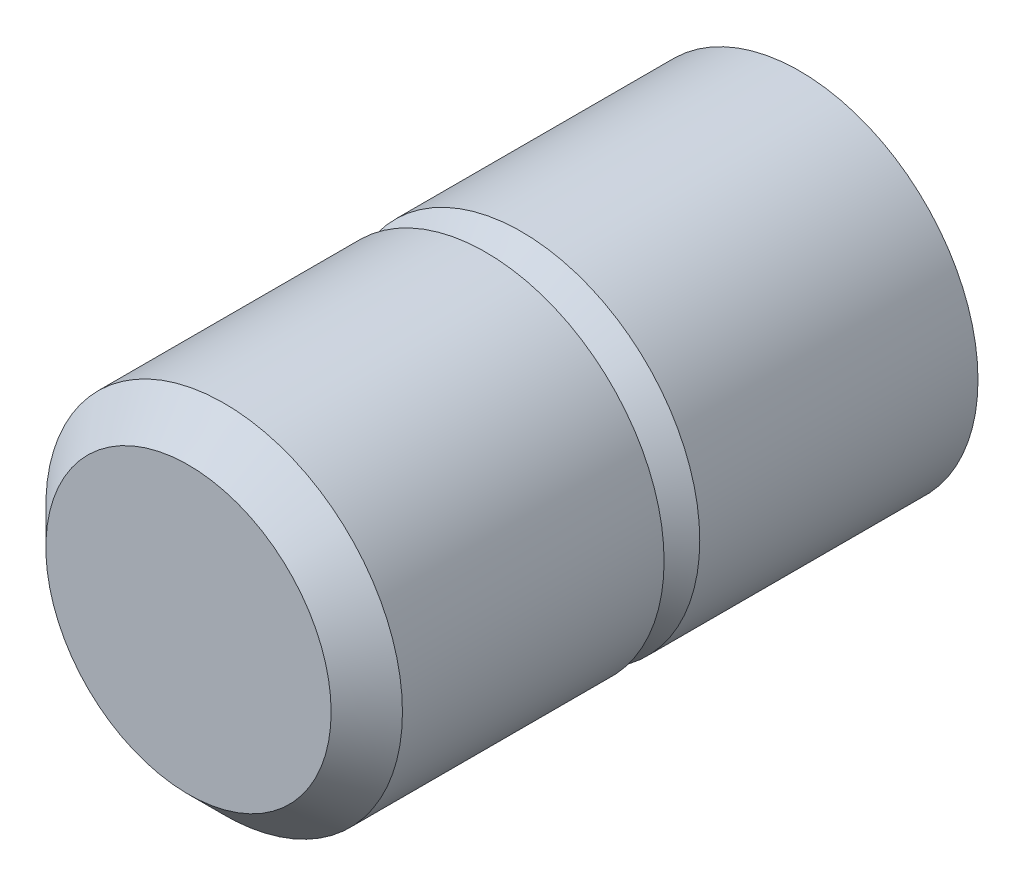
SolidWorks part; units mm, degrees
ref_plane "Front" through (0, 0, 0) normal (0, 0, 1) x (1, 0, 0)
ref_plane "Top" through (0, 0, 0) normal (0, 1, 0) x (1, 0, 0)
ref_plane "Right" through (0, 0, 0) normal (1, 0, 0) x (0, 0, -1)
sketch "Sketch1" plane through (0, 0, 0) normal (1, 0, 0) x (0, 0, -1)
  line L0 (0, 0) -> (65.3053, 0) construction
  line L1 (0, 0) -> (0, 4.8016)
  line L2 (0, 4.8016) -> (1.2004, 6.002)
  line L3 (1.2004, 6.002) -> (10.0076, 6.002)
  line L4 (10.0076, 6.002) -> (10.0076, 4.8016)
  line L5 (10.0076, 4.8016) -> (11.208, 6.002)
  line L6 (11.208, 6.002) -> (20.574, 6.002)
  line L7 (20.574, 6.002) -> (20.574, 4.6406)
  line L8 (20.574, 4.6406) -> (21.6052, 5.1562)
  line L9 (21.6052, 5.1562) -> (52.5628, 5.1562)
  line L10 (52.5628, 5.1562) -> (53.594, 4.125)
  line L11 (53.594, 4.125) -> (53.594, 0)
  line L12 (0, 0) -> (53.594, 0)
  dimension "D" = 12.004
  dimension "DChamp1" = 1.2004
  dimension "DChamp2" = 1.2004
  dimension "E" = 10.0076
  dimension "DChamp4" = 1.2004
  dimension "DChamp3" = 1.2004
  dimension "B" = 20.574
  dimension "CChamp1" = 1.0312
  dimension "A" = 53.594
  dimension "CChamp3" = 1.0312
  dimension "CChamp4" = 1.0312
  dimension "C" = 10.3124
  dimension "D2" = 12.004
  dimension "CChamp5" = 9.2812
revolve "Revolve1" add sketch "Sketch1" angle 360 about L0
sketch "Sketch2" plane through (0, 0, -20.574) normal (0, 0, -1) x (-1, 0, 0)
  circle A0 centre (0, 0) radius 53.975
  dimension "D1" = 107.95
extrude "Type123-N" cut sketch "Sketch2" along normal through all
sketch "123KeyDepth" [suppressed] plane through (0, 0, -28.448) normal (0, 0, -1) x (-1, 0, 0)
  line L0 (0, 0) -> (0, 1.5748) construction
  line L1 (-0.5766, 1.5748) -> (0.5714, 1.5748) construction
  dimension "KeyDepth" = 3.5687
ref_plane "123Plane" [suppressed] through (0, 1.5748, 0) normal (0, -1, 0) x (1, 0, 0)
sketch "Sketch4" [suppressed] plane through (0, 1.5748, 0) normal (0, -1, 0) x (1, 0, 0)
  line L0 (0.0026, -28.448) -> (0.0026, -38.0533) construction
  line L1 (0.5766, -28.448) -> (-0.5714, -28.448) construction
  line L2 (0.8027, -28.448) -> (0.8027, -19.812)
  line L3 (-0.7975, -19.812) -> (-0.7975, -28.448)
  line L5 (-3.9689, -19.812) -> (2.9563, -19.812) construction
  line L6 (-1.8999, -28.448) -> (1.8999, -28.448) construction
  line L7 (-0.7975, -28.448) -> (0.8027, -28.448)
  arc A0 (0.8027, -19.812) -> (-0.7975, -19.812) centre (0.0026, -19.812) ccw
  dimension "F" = 3.175
  dimension "G" = 22.86
extrude "123Key" [suppressed] cut sketch "Sketch4" against normal through all
sketch "Sketch5" plane through (0, 0, -10.0076) normal (0, 0, -1) x (-1, 0, 0)
  circle A0 centre (0, 0) radius 63.5
  dimension "D1" = 127
extrude "Type4" [suppressed] cut sketch "Sketch5" along normal through all
chamfer "Type4-Chamfer" [suppressed] distance 2.54 angle 45
sketch "4KeyDepth" [suppressed] plane through (0, 0, -72.136) normal (0, 0, -1) x (-1, 0, 0)
  line L0 (0, 0) -> (0, 9.525) construction
  line L1 (-17.7759, 9.525) -> (18.3619, 9.525) construction
  dimension "Type4KeyDepth" = 4.732
ref_plane "4Plane" [suppressed] through (0, 9.525, 0) normal (0, -1, 0) x (1, 0, 0)
sketch "Sketch7" [suppressed] plane through (0, 9.525, 0) normal (0, -1, 0) x (1, 0, 0)
  line L0 (-0.293, -72.136) -> (-0.293, -158.7004) construction
  line L1 (17.7759, -72.136) -> (-18.3619, -72.136) construction
  line L2 (2.882, -72.136) -> (2.882, -32.0291)
  line L3 (-3.468, -72.136) -> (-3.468, -32.0291)
  line L4 (-3.468, -72.136) -> (2.882, -72.136)
  line L5 (-10.16, -72.136) -> (10.16, -72.136) construction
  line L6 (-10.16, -72.136) -> (10.16, -72.136) construction
  arc A0 (2.882, -32.0291) -> (-3.468, -32.0291) centre (-0.293, -34.036) ccw
  dimension "4F" = 2.54
  dimension "4G" = 2.54
  dimension "4F2" = 1.27
extrude "4Key" [suppressed] cut sketch "Sketch7" against normal through all
equation "\"DChamp3@Sketch1\"=.1*\"D@Sketch1\""
equation "\"DChamp1@Sketch1\"=.1*\"D@Sketch1\""
equation "\"DChamp2@Sketch1\"=.1*\"D@Sketch1\""
equation "\"DChamp4@Sketch1\"=.1*\"D@Sketch1\""
equation "\"CChamp1@Sketch1\"=.1*\"C@Sketch1\""
equation "\"CChamp5@Sketch1\"=.9*\"C@Sketch1\""
equation "\"CChamp3@Sketch1\"=.1*\"C@Sketch1\""
equation "\"CChamp4@Sketch1\"=.1*\"C@Sketch1\""
equation "\"D2@Sketch1\"=\"D@Sketch1\""
equation "\"KeyDepth@123KeyDepth\"=(\"C@Sketch1\"/2)-(\"F@Sketch4\"/2)"
equation "\"Type4KeyDepth@4KeyDepth\"=(\"D@Sketch1\"/2)-(\"4F@Sketch7\"/2)"
equation "\"4F2@Sketch7\"=\"4F@Sketch7\"/2"
